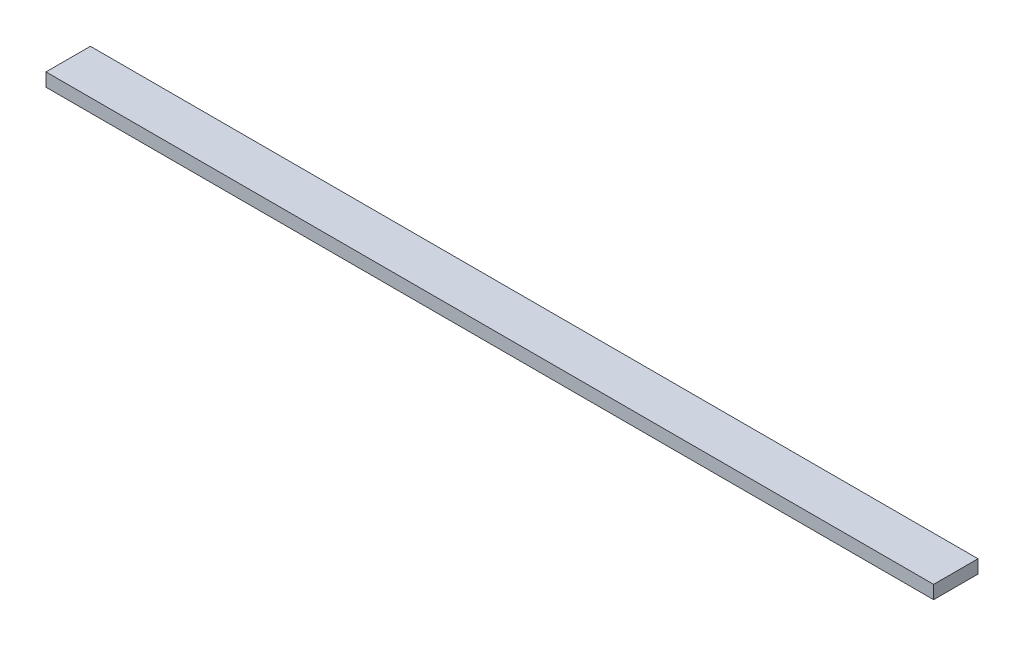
SolidWorks part; units mm, degrees
ref_plane "Plan de face" through (0, 0, 0) normal (0, 0, 1) x (1, 0, 0)
ref_plane "Plan de dessus" through (0, 0, 0) normal (0, 1, 0) x (1, 0, 0)
ref_plane "Plan de droite" through (0, 0, 0) normal (1, 0, 0) x (0, 0, -1)
sketch "Esquisse1" plane through (0, 0, 0) normal (0, 0, 1) x (1, 0, 0)
  line L1 (0, 0) -> (10000, 0)
  line L2 (0, 0) -> (0, -150)
  line L3 (0, -150) -> (10000, -150)
  line L4 (10000, 0) -> (10000, -150)
  dimension "D1" = 150
  dimension "D2" = 10000
extrude "Extrusion1" add sketch "Esquisse1" along normal blind 500
